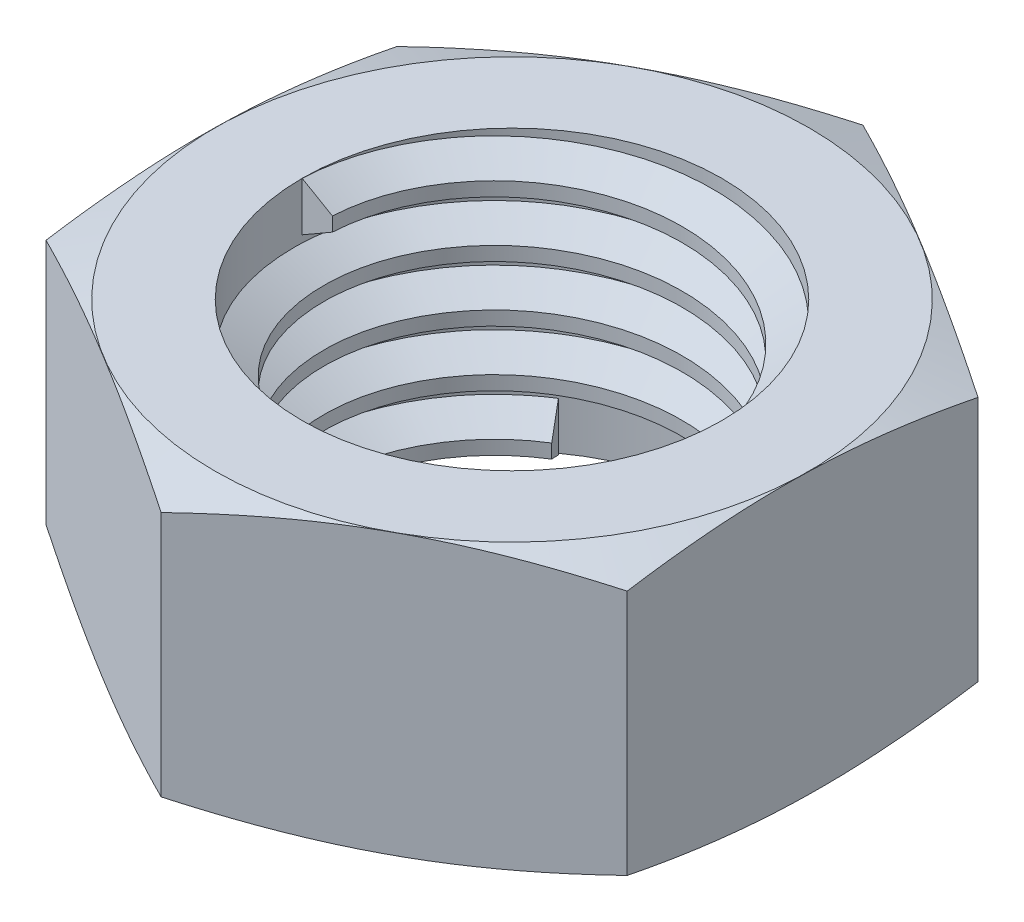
SolidWorks part; units mm, degrees
ref_plane "Front Plane" through (0, 0, 0) normal (0, 0, 1) x (1, 0, 0)
ref_plane "Top Plane" through (0, 0, 0) normal (0, 1, 0) x (1, 0, 0)
ref_plane "Right Plane" through (0, 0, 0) normal (1, 0, 0) x (0, 0, -1)
sketch "Sketch1" plane through (0, 0, 0) normal (0, 1, 0) x (1, 0, 0)
  line L1 (13.3157, -8.0911) -> (13.665, 7.4862)
  line L2 (13.665, 7.4862) -> (0.3493, 15.5773)
  line L3 (0.3493, 15.5773) -> (-13.3157, 8.0911)
  line L4 (-13.3157, 8.0911) -> (-13.665, -7.4862)
  line L5 (-13.665, -7.4862) -> (-0.3493, -15.5773)
  line L6 (-0.3493, -15.5773) -> (13.3157, -8.0911)
  circle A0 centre (0, 0) radius 13.4938 construction
  circle A1 centre (0, 0) radius 9.525
  dimension "D1" = 19.05
extrude "Boss-Extrude1" add sketch "Sketch1" along normal blind 12.7
thread "Thread1" pitch 2.54 start angle 0, offset 0, length 10.541, pitch 2.54, diameter 19.05
ref_plane "Plane1" through (-9.525, 12.7, 0) normal (0, 0, 1) x (-1, 0, 0)
sketch "Thread Profile1" plane through (-9.525, 12.7, 0) normal (0, 0, 1) x (-1, 0, 0)
  line L0 (0, 0) -> (0, 2.54) construction
  line L11 (0, 0) -> (0, 2.2225)
  line L12 (0, 2.2225) -> (-1.3748, 1.4287)
  line L13 (-1.3748, 1.4287) -> (-1.3748, 0.7937)
  line L15 (-1.3748, 0.7937) -> (0, 0)
  line L17 (-1.3748, 1.1112) -> (0, 1.1112) construction
  point P2 (0, 0)
  dimension "Pitch" = 2.54
  dimension "Profile_Angle" = 60
  dimension "Profile_Land" = 0.635
  dimension "Profile_Height" = 1.3748
sketch "Sketch6" plane through (0, 0, 0) normal (0, 0, 1) x (1, 0, 0)
  line L0 (-13.4904, 12.7) -> (-21.6587, 12.7)
  line L1 (-21.6587, 12.7) -> (-21.6587, 9.727)
  line L2 (-21.6587, 9.727) -> (-13.4904, 12.7)
  line L3 (0, 0) -> (0, 5.7732) construction
  line L4 (-13.3157, 12.7) -> (-13.665, 12.7) construction
  line L5 (-13.4904, 0) -> (-19.184, 0)
  line L6 (-19.184, 0) -> (-19.184, 2.0723)
  line L7 (-19.184, 2.0723) -> (-13.4904, 0)
  dimension "D1" = 20
  dimension "D2" = 20
revolve "Cut-Revolve2" cut sketch "Sketch6" angle 360 about L3
